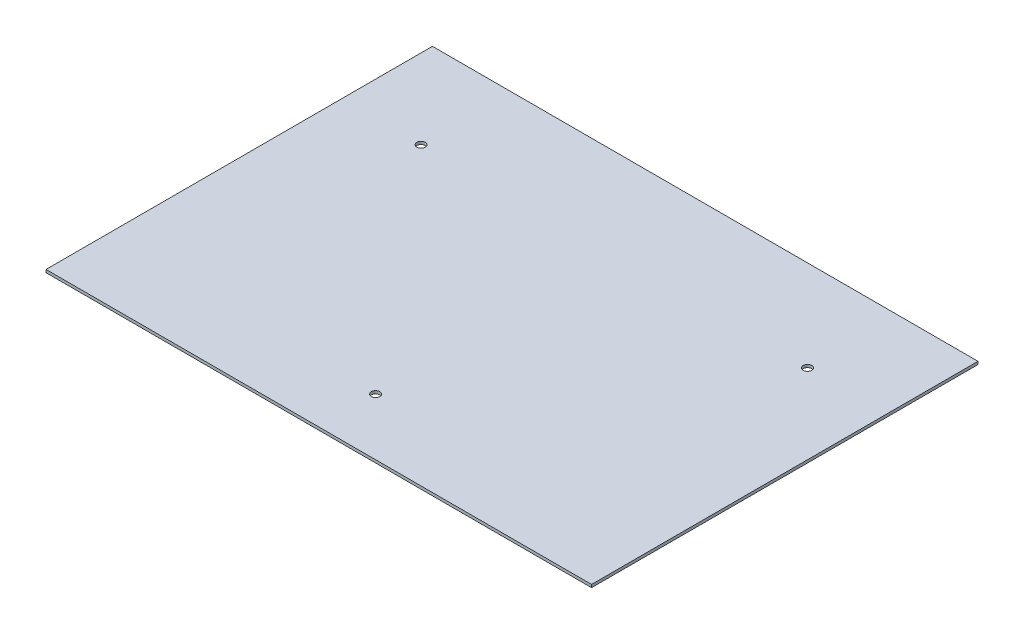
SolidWorks part; units mm, degrees
ref_plane "Front Plane" through (0, 0, 0) normal (0, 0, 1) x (1, 0, 0)
ref_plane "Top Plane" through (0, 0, 0) normal (0, 1, 0) x (1, 0, 0)
ref_plane "Right Plane" through (0, 0, 0) normal (1, 0, 0) x (0, 0, -1)
sketch "Sketch1" plane through (0, 0, 0) normal (0, 1, 0) x (1, 0, 0)
  line L1 (-304.8, -215.9) -> (304.8, -215.9)
  line L2 (-304.8, -215.9) -> (-304.8, 215.9)
  line L3 (-304.8, 215.9) -> (304.8, 215.9)
  line L4 (304.8, -215.9) -> (304.8, 215.9)
  line L5 (-304.8, -215.9) -> (304.8, 215.9) construction
  line L6 (-304.8, 215.9) -> (304.8, -215.9) construction
  point P0 (0, 0)
  dimension "D1" = 609.6
  dimension "D2" = 431.8
extrude "Boss-Extrude1" add sketch "Sketch1" along normal blind 3.175
sketch "Sketch2" plane through (0, 3.175, 0) normal (0, 1, 0) x (1, 0, 0)
  line L0 (0, 114.3) -> (0, -152.4) construction
  line L2 (-215.9, 114.3) -> (215.9, 114.3) construction
  line L4 (215.9, 114.3) -> (304.8, 114.3) construction
  line L6 (304.8, -215.9) -> (304.8, 215.9) construction
  line L7 (-215.9, 114.3) -> (-304.8, 114.3) construction
  line L8 (-304.8, 215.9) -> (-304.8, -215.9) construction
  line L11 (0, -152.4) -> (0, -215.9) construction
  line L12 (-304.8, -215.9) -> (304.8, -215.9) construction
  circle A0 centre (-215.9, 114.3) radius 4.7625
  circle A1 centre (215.9, 114.3) radius 4.7625
  circle A2 centre (0, -152.4) radius 4.7625
  dimension "D3" = 9.525
  dimension "D1" = 431.8
  dimension "D2" = 266.7
  dimension "D4" = 63.5
extrude "Cut-Extrude1" cut sketch "Sketch2" along direction (0, -1, 0) on the side against the normal through all
